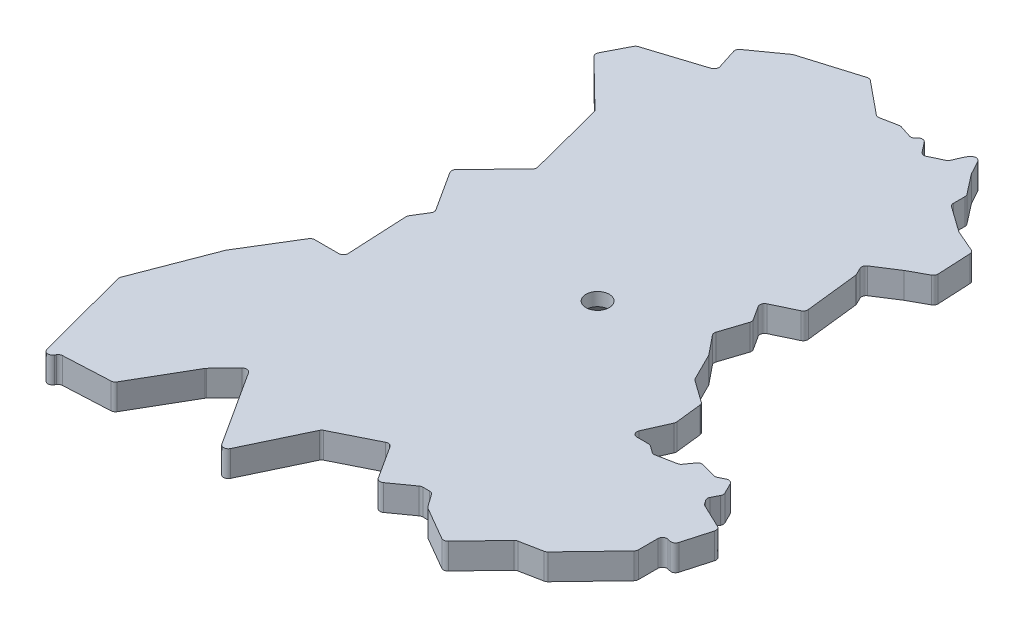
SolidWorks part; units mm, degrees
ref_plane "Plan de face" through (0, 0, 0) normal (0, 0, 1) x (1, 0, 0)
ref_plane "Plan de dessus" through (0, 0, 0) normal (0, 1, 0) x (1, 0, 0)
ref_plane "Plan de droite" through (0, 0, 0) normal (1, 0, 0) x (0, 0, -1)
sketch "Esquisse1" plane through (0, 0, 0) normal (0, 1, 0) x (1, 0, 0)
  line L0 (-10.9415, 63.5951) -> (-3.8697, 57.8205)
  line L1 (-3.8697, 57.8205) -> (0, 58.581)
  line L2 (0, 58.581) -> (3.1031, 57.5672)
  line L3 (3.1031, 57.5672) -> (4.3065, 59.041)
  line L4 (4.3065, 59.041) -> (6.9167, 55.6814)
  line L5 (6.9167, 55.6814) -> (10.434, 57.3612)
  line L6 (10.434, 57.3612) -> (11.4467, 59.7042)
  line L7 (11.4467, 59.7042) -> (12.7355, 61.2825)
  line L8 (12.7355, 61.2825) -> (14.8866, 57.3612)
  line L9 (14.8866, 57.3612) -> (18.0429, 53.2987)
  line L10 (18.0429, 53.2987) -> (18.0429, 50.268)
  line L11 (18.0429, 50.268) -> (23.371, 46.4771)
  line L12 (23.371, 46.4771) -> (28.0634, 44.449)
  line L13 (28.0634, 44.449) -> (28.4368, 36.8806)
  line L14 (28.4368, 36.8806) -> (24.5121, 34.7277)
  line L15 (24.5121, 34.7277) -> (19.5707, 31.5435)
  line L16 (19.5707, 31.5435) -> (20.6298, 29.3259)
  line L17 (20.6298, 29.3259) -> (21.8779, 18.2923)
  line L18 (21.8779, 18.2923) -> (15.9036, 15.4391)
  line L19 (15.9036, 15.4391) -> (18.4122, 11.5462)
  line L20 (18.4122, 11.5462) -> (16.5195, 5.7526)
  line L21 (16.5195, 5.7526) -> (19.8271, 1.6625)
  line L22 (19.8271, 1.6625) -> (22.5348, -3.7669)
  line L23 (22.5348, -3.7669) -> (27.2828, -7.1452)
  line L24 (27.2828, -7.1452) -> (27.9258, -12.8298)
  line L25 (27.9258, -12.8298) -> (25.2043, -18.9895)
  line L26 (25.2043, -18.9895) -> (29.1202, -18.9895)
  line L27 (29.1202, -18.9895) -> (30.963, -20.3007)
  line L28 (30.963, -20.3007) -> (35.3271, -19.443)
  line L29 (35.3271, -19.443) -> (37.0266, -17.0544)
  line L30 (37.0266, -17.0544) -> (40.778, -18.1166)
  line L31 (40.778, -18.1166) -> (43.0387, -16.9892)
  line L32 (43.0387, -16.9892) -> (44.6667, -20.2536)
  line L33 (44.6667, -20.2536) -> (43.5111, -22.4927)
  line L34 (43.5111, -22.4927) -> (44.4632, -23.8262)
  line L35 (44.4632, -23.8262) -> (50.0119, -26.4672)
  line L36 (50.0119, -26.4672) -> (48.0432, -33.4201)
  line L37 (48.0432, -33.4201) -> (45.6044, -32.8059)
  line L38 (45.6044, -32.8059) -> (45.6044, -38.0738)
  line L39 (45.6044, -38.0738) -> (37.0266, -47.0186)
  line L40 (37.0266, -47.0186) -> (32.2017, -47.9668)
  line L41 (32.2017, -47.9668) -> (25.3001, -55.1638)
  line L42 (25.3001, -55.1638) -> (18.1733, -51.031)
  line L43 (18.1733, -51.031) -> (16.0537, -48.0624)
  line L44 (16.0537, -48.0624) -> (13.9825, -48.0624)
  line L45 (13.9825, -48.0624) -> (8.9661, -51.6441)
  line L46 (8.9661, -51.6441) -> (3.9019, -43.7851)
  line L47 (3.9019, -43.7851) -> (-5.1006, -48.2747)
  line L48 (-5.1006, -48.2747) -> (-11.471, -61.6589)
  line L49 (-11.471, -61.6589) -> (-22.3434, -44.7865)
  line L50 (-22.3434, -44.7865) -> (-26.6003, -49.1401)
  line L51 (-26.6003, -49.1401) -> (-33.1322, -60.4041)
  line L52 (-33.1322, -60.4041) -> (-43.0798, -60.8949)
  line L53 (-43.0798, -60.8949) -> (-44.558, -63.444)
  line L54 (-44.558, -63.444) -> (-50.1612, -42.3717)
  line L55 (-50.1612, -42.3717) -> (-44.4344, -27.4443)
  line L56 (-44.4344, -27.4443) -> (-38.106, -17.0836)
  line L57 (-38.106, -17.0836) -> (-32.0006, -17.0836)
  line L58 (-32.0006, -17.0836) -> (-32.6364, -4.1965)
  line L59 (-32.6364, -4.1965) -> (-30.5855, -0.8388)
  line L60 (-30.5855, -0.8388) -> (-36.172, 7.8308)
  line L61 (-36.172, 7.8308) -> (-28.0597, 16.1274)
  line L62 (-28.0597, 16.1274) -> (-32.0477, 31.5435)
  line L63 (-32.0477, 31.5435) -> (-41.7595, 41.0395)
  line L64 (-41.7595, 41.0395) -> (-38.9895, 46.4064)
  line L65 (-38.9895, 46.4064) -> (-27.1239, 50.1933)
  line L66 (-27.1239, 50.1933) -> (-28.8284, 55.5342)
  line L67 (-28.8284, 55.5342) -> (-22.3913, 60.1303)
  line L68 (-22.3913, 60.1303) -> (-10.9415, 63.5951)
  spline S0 degree 3 number of poles 111 (50.0119, -26.4672) -> (-10.9415, 63.5951) construction
  spline S1 degree 3 number of poles 137 (-26.0265, -48.4229) -> (50.0119, -26.4672) construction
  spline S2 degree 3 number of poles 271 (-10.9415, 63.5951) -> (-26.6003, -49.1401) construction
extrude "Boss.-Extru.1" add sketch "Esquisse1" along normal blind 5
fillet "Congé1" radius 0.9 68 edges at (-32.0006, 2.5, 17.0836) (-38.106, 2.5, 17.0836) (-44.4344, 2.5, 27.4443) (-50.1612, 2.5, 42.3717) (-32.6364, 2.5, 4.1965) (-30.5855, 2.5, 0.8388) (-36.172, 2.5, -7.8308) (-28.0597, 2.5, -16.1274) (-32.0477, 2.5, -31.5435) (-38.9895, 2.5, -46.4064) (-41.7595, 2.5, -41.0395) (-27.1239, 2.5, -50.1933) (-28.8284, 2.5, -55.5342) (-22.3913, 2.5, -60.1303) (-10.9415, 2.5, -63.5951) (-3.8697, 2.5, -57.8205) (0, 2.5, -58.581) (3.1031, 2.5, -57.5672) (4.3065, 2.5, -59.041) (6.9167, 2.5, -55.6814) (10.434, 2.5, -57.3612) (11.4467, 2.5, -59.7042) (12.7355, 2.5, -61.2825) (14.8866, 2.5, -57.3612) (18.0429, 2.5, -53.2987) (18.0429, 2.5, -50.268) (23.371, 2.5, -46.4771) (28.0634, 2.5, -44.449) (28.4368, 2.5, -36.8806) (19.5707, 2.5, -31.5435) (20.6298, 2.5, -29.3259) (21.8779, 2.5, -18.2923) (15.9036, 2.5, -15.4391) (18.4122, 2.5, -11.5462) (16.5195, 2.5, -5.7526) (19.8271, 2.5, -1.6625) (22.5348, 2.5, 3.7669) (27.2828, 2.5, 7.1452) (27.9258, 2.5, 12.8298) (25.2043, 2.5, 18.9895) (29.1202, 2.5, 18.9895) (30.963, 2.5, 20.3007) (35.3271, 2.5, 19.443) (37.0266, 2.5, 17.0544) (40.778, 2.5, 18.1166) (43.0387, 2.5, 16.9892) (44.6667, 2.5, 20.2536) (43.5111, 2.5, 22.4927) (44.4632, 2.5, 23.8262) (50.0119, 2.5, 26.4672) (48.0432, 2.5, 33.4201) (45.6044, 2.5, 32.8059) (45.6044, 2.5, 38.0738) (37.0266, 2.5, 47.0186) (32.2017, 2.5, 47.9668) (25.3001, 2.5, 55.1638) (18.1733, 2.5, 51.031) (16.0537, 2.5, 48.0624) (13.9825, 2.5, 48.0624) (8.9661, 2.5, 51.6441) (3.9019, 2.5, 43.7851) (-5.1006, 2.5, 48.2747) (-11.471, 2.5, 61.6589) (-22.3434, 2.5, 44.7865) (-26.6003, 2.5, 49.1401) (-33.1322, 2.5, 60.4041) (-43.0798, 2.5, 60.8949) (-44.558, 2.5, 63.444)
hole_wizard "Fraisage pour vis à tête fraisée M41" positions "Esquisse3" profile "Esquisse2" countersink size "M4" standard "ISO"
sketch "Esquisse3" plane through (0, 0, 0) normal (0, -1, 0) x (-1, 0, 0)
  point P0 (0, 0)
sketch "Esquisse2" plane through (0, 0, 0) normal (1, 0, 0) x (0, 0, -1)
  line L0 (0, 0) -> (0, 5)
  line L1 (0, 5) -> (2.25, 5)
  line L2 (2.25, 5) -> (2.25, 2.45)
  line L3 (2.25, 2.45) -> (4.7, 0)
  line L5 (4.7, 0) -> (0, 0)
  line L6 (-2.25, 2.45) -> (-4.7, 0) construction
  line L11 (0, -6.35) -> (0, 107.95) construction
  dimension "Diamètre du perçage jusqu'au prochain" = 4.5
  dimension "Profondeur du perçage jusqu'au prochain" = 5
  dimension "Diamètre du fraisage entrant" = 9.4
  dimension "Angle du fraisage entrant" = 90
